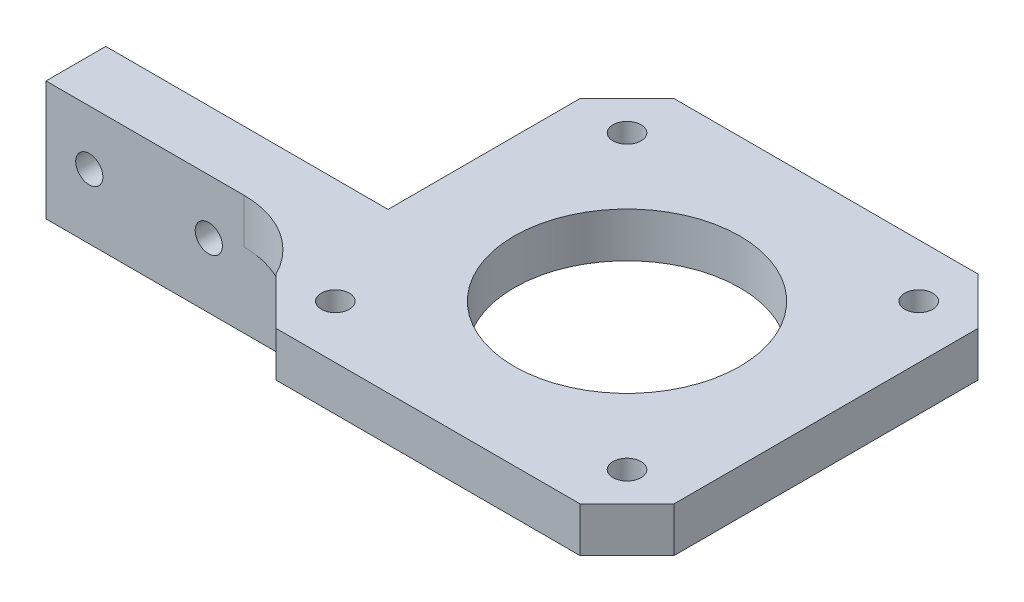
SolidWorks part; units mm, degrees
ref_plane "Front Plane" through (0, 0, 0) normal (0, 0, 1) x (1, 0, 0)
ref_plane "Top Plane" through (0, 0, 0) normal (0, 1, 0) x (1, 0, 0)
ref_plane "Right Plane" through (0, 0, 0) normal (1, 0, 0) x (0, 0, -1)
sketch "Sketch2" plane through (0, 0, 0) normal (0, 1, 0) x (1, 0, 0)
  line L0 (21.15, -16.15) -> (21.15, 16.15)
  line L1 (21.15, 16.15) -> (16.15, 21.15)
  line L2 (16.15, 21.15) -> (-16.15, 21.15)
  line L3 (-16.15, 21.15) -> (-21.15, 16.15)
  line L4 (-21.15, 16.15) -> (-21.15, -16.15)
  line L5 (-21.15, -16.15) -> (-16.15, -21.15)
  line L6 (-16.15, -21.15) -> (16.15, -21.15)
  line L7 (16.15, -21.15) -> (21.15, -16.15)
  circle A0 centre (-15.5, 15.5) radius 1.25 construction
  circle A1 centre (15.5, 15.5) radius 1.25 construction
  circle A2 centre (15.5, -15.5) radius 1.25 construction
  circle A3 centre (-15.5, -15.5) radius 1.25 construction
  circle A4 centre (0, 0) radius 11 construction
  circle A5 centre (0, 0) radius 12
  circle A6 centre (-15.5, 15.5) radius 1.49
  circle A7 centre (15.5, 15.5) radius 1.49
  circle A8 centre (15.5, -15.5) radius 1.49
  circle A9 centre (-15.5, -15.5) radius 1.49
  dimension "D2" = 24
  dimension "D1" = 2.98
extrude "Boss-Extrude2" add sketch "Sketch2" along normal blind 4.7625
sketch "Sketch3" plane through (-21.15, 0, 0) normal (-1, 0, 0) x (0, 0, 1)
  line L0 (-16.15, 0) -> (16.15, 0) construction
  line L1 (4.25, 0) -> (10.6, 0)
  line L2 (4.25, 0) -> (4.25, 12.7)
  line L3 (4.25, 12.7) -> (10.6, 12.7)
  line L4 (10.6, 0) -> (10.6, 12.7)
  line L5 (4.25, -3.7) -> (4.25, 161.4) construction
  dimension "D1" = 6.35
  dimension "D2" = 12.7
extrude "Boss-Extrude3" add sketch "Sketch3" along normal blind 30
fillet "Fillet1" radius 10 1 edges at (-21.15, 2.3813, 10.6)
fillet "Fillet2" radius 10 1 edges at (-21.15, 4.7625, 7.425)
sketch "Sketch4" plane through (0, 0, 4.25) normal (0, 0, -1) x (-1, 0, 0)
  circle A0 centre (46.55, 5.825) radius 1.445
  dimension "D1" = 2.89
extrude "Cut-Extrude1" cut sketch "Sketch4" against normal through all
mirror "Mirror1" about plane through (0, 0, 0) normal (0, 1, 0)
sketch "Sketch5" plane through (0, 12.7, 0) normal (0, 1, 0) x (1, 0, 0)
  line L1 (-75.9416, 39.6973) -> (67.0308, 39.6973)
  line L2 (-75.9416, 39.6973) -> (-75.9416, -40.3176)
  line L3 (-75.9416, -40.3176) -> (67.0308, -40.3176)
  line L4 (67.0308, 39.6973) -> (67.0308, -40.3176)
extrude "Cut-Extrude2" cut sketch "Sketch5" against normal up to vertex
sketch "Sketch6" plane through (0, 0, 4.25) normal (0, 0, -1) x (-1, 0, 0)
  circle A0 centre (33.85, -5.825) radius 1.445
  circle A1 centre (46.55, -5.825) radius 1.445 construction
extrude "Cut-Extrude3" cut sketch "Sketch6" against normal through all both and the other way through all
